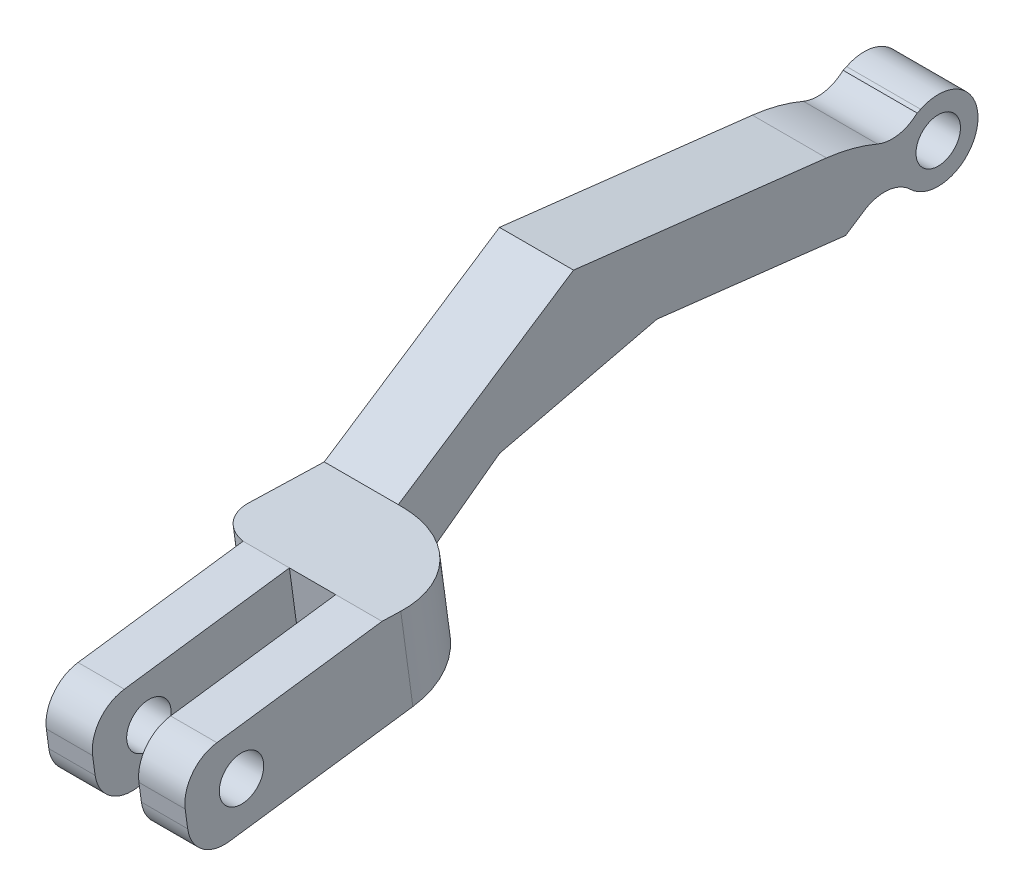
SolidWorks part; units mm, degrees
ref_plane "Front Plane" through (0, 0, 0) normal (0, 0, 1) x (1, 0, 0)
ref_plane "Top Plane" through (0, 0, 0) normal (0, 1, 0) x (1, 0, 0)
ref_plane "Right Plane" through (0, 0, 0) normal (1, 0, 0) x (0, 0, -1)
body saved out of another part "-SF lincage revisi 2-1"
